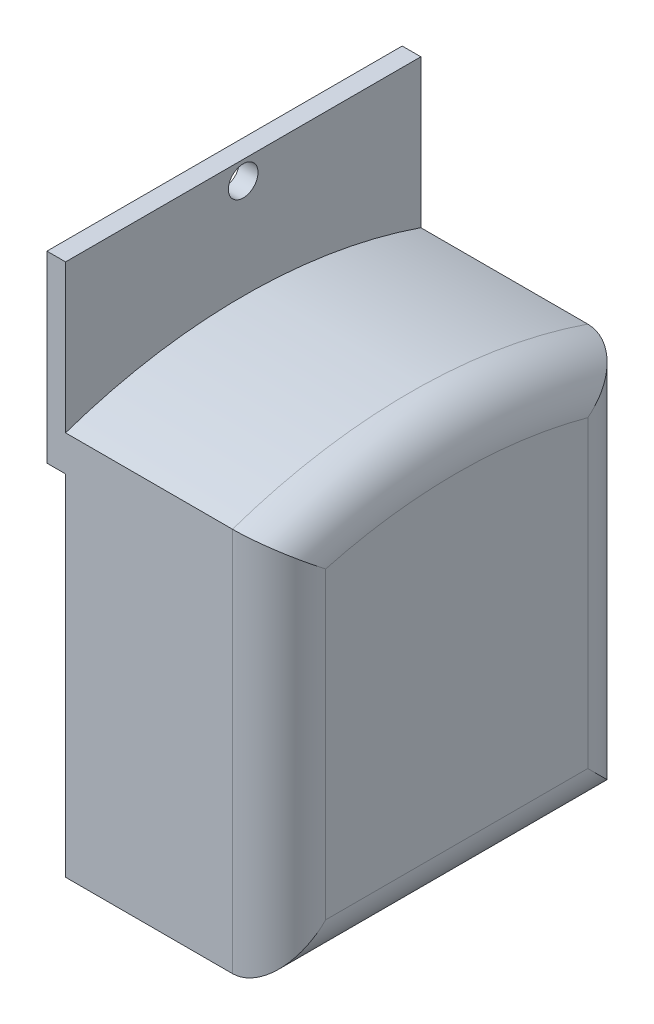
SolidWorks part; units mm, degrees
ref_plane "Front Plane" through (0, 0, 0) normal (0, 0, 1) x (1, 0, 0)
ref_plane "Top Plane" through (0, 0, 0) normal (0, 1, 0) x (1, 0, 0)
ref_plane "Right Plane" through (0, 0, 0) normal (1, 0, 0) x (0, 0, -1)
sketch "Sketch1" plane through (0, 0, 0) normal (0, 0, 1) x (1, 0, 0)
  line L8 (0, 0) -> (0, 49.5132)
  line L9 (0, 76.2) -> (45.8, 76.2)
  line L10 (45.8, 76.2) -> (45.8, 0)
  line L11 (45.8, 0) -> (0, 0)
  line L12 (0, 49.5132) -> (-4, 49.5132)
  line L13 (-4, 49.5132) -> (-4, 88.9)
  line L14 (-4, 88.9) -> (0, 88.9)
  line L15 (0, 88.9) -> (0, 76.2)
  dimension "D1" = 45.8
  dimension "D2" = 76.2
  dimension "D3" = 4
  dimension "D4" = 12.7
extrude "Boss-Extrude1" add sketch "Sketch1" along normal blind 76.2
sketch "Sketch2" plane through (0, 0, 0) normal (1, 0, 0) x (0, 0, -1)
  line L0 (-38.1, 88.9) -> (-38.1, 84.9)
  line L1 (-76.2, 88.9) -> (0, 88.9) construction
  circle A0 centre (-38.1, 84.9) radius 3.175
  dimension "D2" = 6.35
  dimension "D1" = 4
extrude "Cut-Extrude1" cut sketch "Sketch2" against normal blind 76.2
sketch "Sketch3" plane through (45.8, 0, 0) normal (1, 0, 0) x (0, 0, -1)
  line L2 (-38.1, 76.2) -> (-38.1, 63.5) construction
  line L3 (-76.2, 76.2) -> (0, 76.2) construction
  line L4 (-38.1, 63.5) -> (-38.1, 57.15)
  line L5 (-76.2, 0) -> (-76.2, 76.2) construction
  line L6 (0, 0) -> (0, 76.2) construction
  line L7 (-76.2, 57.15) -> (-76.2, 76.2)
  line L8 (-76.2, 76.2) -> (0, 76.2)
  line L9 (0, 76.2) -> (0, 57.15)
  arc A2 (-76.2, 57.15) -> (0, 57.15) centre (-38.1, -53.5755) cw
  dimension "D1" = 12.7
  dimension "D2" = 6.35
extrude "Cut-Extrude3" cut sketch "Sketch3" against normal blind 45.8 contours L2 A2 M6 M5 | L2 L8 A2 M7
sketch "Sketch4" plane through (0, 0, 76.2) normal (0, 0, 1) x (1, 0, 0)
  line L0 (0, 0) -> (0, -25.4)
  line L1 (45.8, 0) -> (45.8, -25.4)
  line L2 (45.8, -25.4) -> (0, -25.4)
  line L3 (0, 0) -> (45.8, 0)
  dimension "D1" = 25.4
extrude "Boss-Extrude2" add sketch "Sketch4" against normal blind 76.2
fillet "Fillet3" radius 10 4 edges at (45.8, -25.4, 38.1) (45.8, 15.875, 76.2) (45.8, 63.5217, 38.1) (45.8, 15.875, 0)
